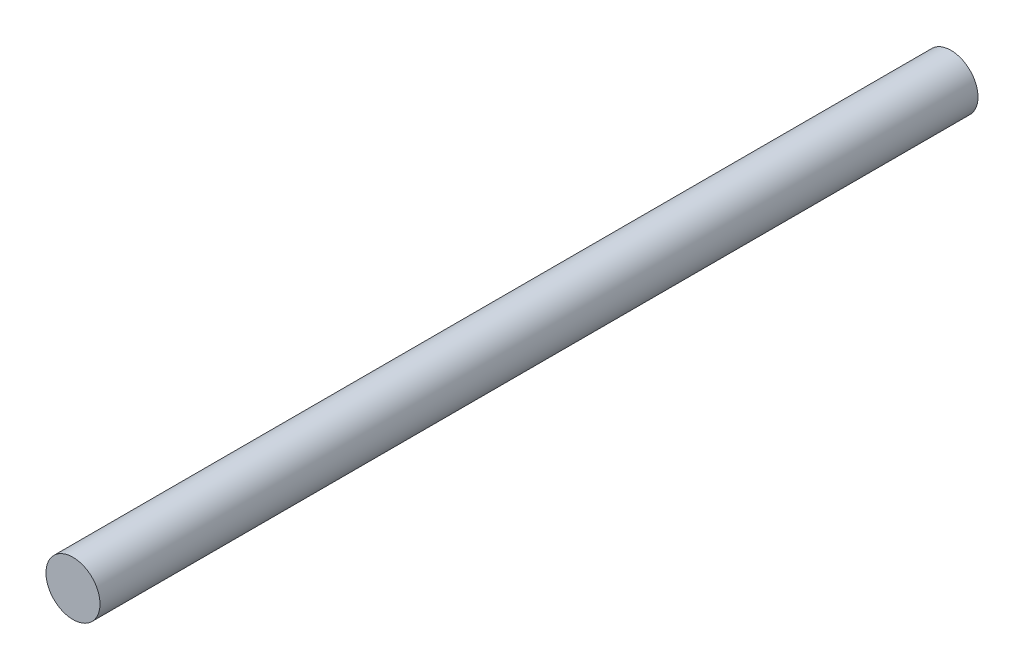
SolidWorks part; units mm, degrees
ref_plane "Front" through (0, 0, 0) normal (0, 0, 1) x (1, 0, 0)
ref_plane "Top" through (0, 0, 0) normal (0, 1, 0) x (1, 0, 0)
ref_plane "Right" through (0, 0, 0) normal (1, 0, 0) x (0, 0, -1)
sketch "Sketch1" plane through (0, 0, 0) normal (0, 0, 1) x (1, 0, 0)
  circle A0 centre (0, 0) radius 4
  dimension "D1" = 8
extrude "Boss-Extrude1" add sketch "Sketch1" along normal blind 130
